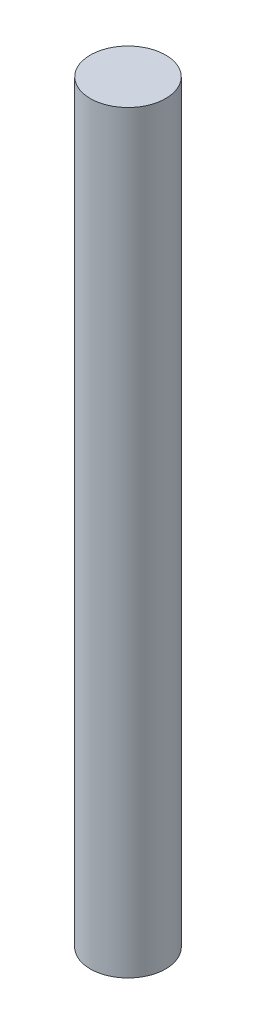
SolidWorks part; units mm, degrees
ref_plane "Front Plane" through (0, 0, 0) normal (0, 0, 1) x (1, 0, 0)
ref_plane "Top Plane" through (0, 0, 0) normal (0, 1, 0) x (1, 0, 0)
ref_plane "Right Plane" through (0, 0, 0) normal (1, 0, 0) x (0, 0, -1)
sketch "Sketch1" plane through (0, 0, 0) normal (0, 1, 0) x (1, 0, 0)
  circle A0 centre (0, 0) radius 2.54
  dimension "D1" = 5.08
extrude "Boss-Extrude1" add sketch "Sketch1" along normal blind 50.8
